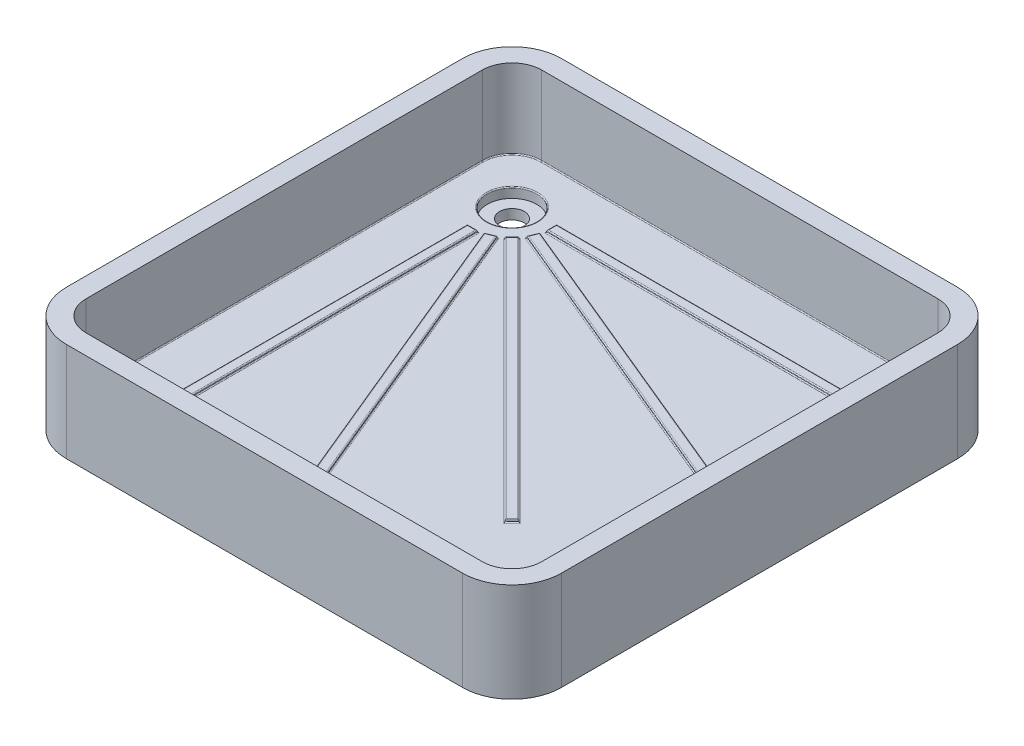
SolidWorks part; units mm, degrees
ref_plane "Plan de face" through (0, 0, 0) normal (0, 0, 1) x (1, 0, 0)
ref_plane "Plan de dessus" through (0, 0, 0) normal (0, 1, 0) x (1, 0, 0)
ref_plane "Plan de droite" through (0, 0, 0) normal (1, 0, 0) x (0, 0, -1)
sketch "Esquisse1" plane through (0, 0, 0) normal (0, 1, 0) x (1, 0, 0)
  line L1 (500, -500) -> (-500, -500)
  line L2 (500, -500) -> (500, 500)
  line L3 (500, 500) -> (-500, 500)
  line L4 (-500, -500) -> (-500, 500)
  line L5 (500, -500) -> (-500, 500) construction
  line L6 (500, 500) -> (-500, -500) construction
  point P0 (0, 0)
  dimension "D1" = 1000
  dimension "D2" = 1000
extrude "Boss.-Extru.1" add sketch "Esquisse1" along normal blind 200
fillet "Congé1" radius 100 4 edges at (-500, 100, -500) (500, 100, -500) (-500, 100, 500) (500, 100, 500)
shell "Coque1" thickness 40
sketch "Esquisse2" plane through (0, 40, 0) normal (0, 1, 0) x (1, 0, 0)
  line L0 (-500, 400) -> (-500, -400) construction
  line L1 (400, 500) -> (-400, 500) construction
  circle A0 centre (-350, 350) radius 50
  dimension "D2" = 150
  dimension "D3" = 100
  dimension "D1" = 150
extrude "Enlèv. mat.-Extru.1" cut sketch "Esquisse2" against normal blind 20
sketch "Esquisse3" plane through (0, 20, 0) normal (0, 1, 0) x (1, 0, 0)
  circle A0 centre (-350, 350) radius 25
  dimension "D1" = 50
extrude "Enlèv. mat.-Extru.2" cut sketch "Esquisse3" against normal blind 20
sketch "Esquisse4" plane through (0, 40, 0) normal (0, 1, 0) x (1, 0, 0)
  line L1 (430, 340) -> (-270, 340)
  line L2 (430, 340) -> (430, 360)
  line L3 (430, 360) -> (-270, 360)
  line L4 (-270, 340) -> (-270, 360)
  line L5 (430, 340) -> (-270, 360) construction
  line L6 (430, 360) -> (-270, 340) construction
  circle A0 centre (-350, 350) radius 25 construction
  point P0 (80, 350)
  dimension "D1" = 20
  dimension "D2" = 700
  dimension "D3" = 10
  dimension "D4" = 80
extrude "Boss.-Extru.2" add sketch "Esquisse4" along normal blind 5
ref_axis "Axe1" through (-350, 20, -350) along (0, 1, 0)
pattern_circular "Répétition circulaire1" count 5 over 90 about axis through (-350, 0, -350) along (0, 1, 0) of "Boss.-Extru.2"
fillet "Congé2" radius 2 49 edges at (80, 45, -360) (430, 45, -350) (80, 45, -340) (-270, 45, -350) (51.095, 45, -194.6849) (370.626, 45, -51.5069) (43.4414, 45, -176.2073) (-276.0896, 45, -319.3853) (-38.873, 45, -53.0152) (201.5433, 45, 201.5433) (-53.0152, 45, -38.873) (-293.4315, 45, -293.4315) (-340, 45, 80) (-350, 45, 430) (-360, 45, 80) (-350, 45, -270) (-176.2073, 45, 43.4414) (-51.5069, 45, 370.626) (-194.6849, 45, 51.095) (-319.3853, 45, -276.0896) (-350, 40, 430) (-340, 40, 80) (-350, 40, -270) (-360, 40, 80) (-51.5069, 40, 370.626) (-176.2073, 40, 43.4414) (-319.3853, 40, -276.0896) (-194.6849, 40, 51.095) (201.5433, 40, 201.5433) (-38.873, 40, -53.0152) (-293.4315, 40, -293.4315) (-53.0152, 40, -38.873) (370.626, 40, -51.5069) (51.095, 40, -194.6849) (-276.0896, 40, -319.3853) (43.4414, 40, -176.2073) (430, 40, -350) (80, 40, -360) (-270, 40, -350) (80, 40, -340) (-442.4264, 40, -442.4264) (0, 40, -460) (442.4264, 40, -442.4264) (460, 40, 0) (442.4264, 40, 442.4264) (0, 40, 460) (-442.4264, 40, 442.4264) (-460, 40, 0) (-350, 40, -300)
